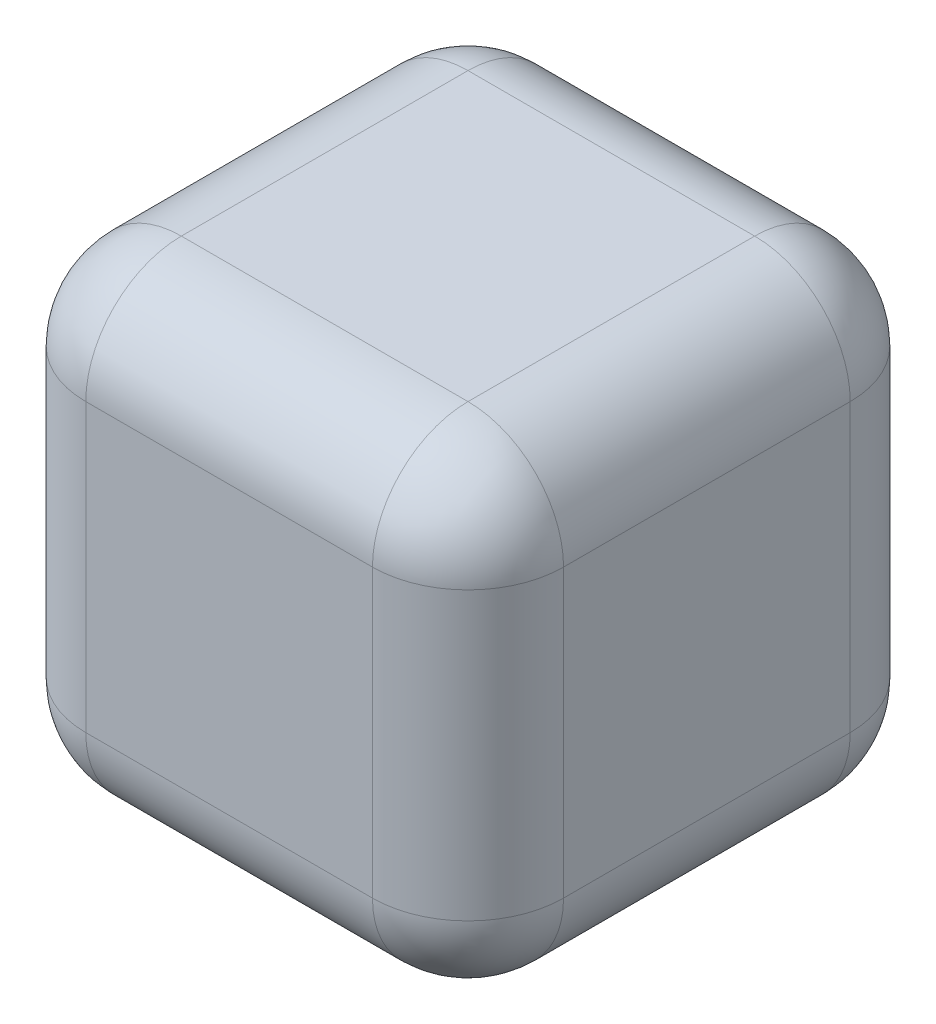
SolidWorks part; units mm, degrees
ref_plane "Front Plane" through (0, 0, 0) normal (0, 0, 1) x (1, 0, 0)
ref_plane "Top Plane" through (0, 0, 0) normal (0, 1, 0) x (1, 0, 0)
ref_plane "Right Plane" through (0, 0, 0) normal (1, 0, 0) x (0, 0, -1)
sketch "Sketch1" plane through (0, 0, 0) normal (0, 0, 1) x (1, 0, 0)
  line L1 (0, 0) -> (10, 0)
  line L2 (0, 0) -> (0, 10)
  line L3 (0, 10) -> (10, 10)
  line L4 (10, 0) -> (10, 10)
  dimension "D1" = 10
  dimension "D2" = 10
extrude "Boss-Extrude1" add sketch "Sketch1" along normal blind 10
fillet "Fillet1" radius 2 12 edges at (0, 5, 0) (5, 0, 0) (10, 5, 0) (5, 10, 0) (0, 5, 10) (5, 0, 10) (10, 5, 10) (5, 10, 10) (0, 10, 5) (10, 0, 5) (0, 0, 5) (10, 10, 5)
